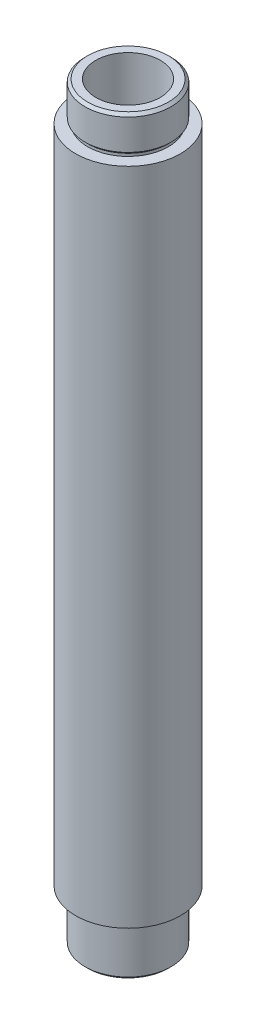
SolidWorks part; units mm, degrees
ref_plane "Plane1" through (0, 0, 0) normal (0, 0, 1) x (1, 0, 0)
ref_plane "Plane2" through (0, 0, 0) normal (0, 1, 0) x (1, 0, 0)
ref_plane "Plane3" through (0, 0, 0) normal (1, 0, 0) x (0, 0, -1)
sketch "Sketch1" plane through (0, 0, 0) normal (0, 0, 1) x (1, 0, 0)
  line L0 (0, 0) -> (0, 95.25) construction
  line L1 (11.9063, 3.3337) -> (15.4686, 3.3337)
  line L2 (15.4686, 3.3337) -> (15.4686, 198.2575)
  line L3 (15.4686, 198.2575) -> (11.9062, 198.2575)
  line L4 (11.9062, 198.2575) -> (11.9062, 199.0513)
  line L5 (11.9062, 199.0513) -> (12.7, 199.845)
  line L6 (12.7, 199.845) -> (12.7, 208.8938)
  line L7 (11.9062, 209.6875) -> (12.7, 208.8938)
  line L8 (11.9062, 209.6875) -> (9.525, 209.6875)
  line L9 (9.525, 209.6875) -> (9.525, 12.7)
  line L10 (9.525, 12.7) -> (9.525, -11.9062)
  line L11 (9.525, -11.9062) -> (11.9063, -11.9063)
  line L12 (12.7, -11.1125) -> (12.7, 1.778)
  line L13 (11.9063, -11.9063) -> (12.7, -11.1125)
  line L14 (11.9063, 3.3337) -> (11.9063, 2.5717)
  line L15 (11.9063, 2.5717) -> (12.7, 1.778)
  dimension "D1" = 15.4686
  dimension "D2" = 9.525
  dimension "D3" = 12.7
  dimension "D4" = 0.7937
  dimension "D5" = 0.7937
  dimension "D6" = 0.7937
  dimension "D7" = 194.9238
  dimension "D8" = 11.43
  dimension "D9" = 0.7937
  dimension "D10" = 0.7937
  dimension "D11" = 0.762
  dimension "D12" = 12.7
  dimension "D13" = 15.24
  dimension "D14" = 0.7937
revolve "Base-Revolve" add sketch "Sketch1" angle 360 about L0
